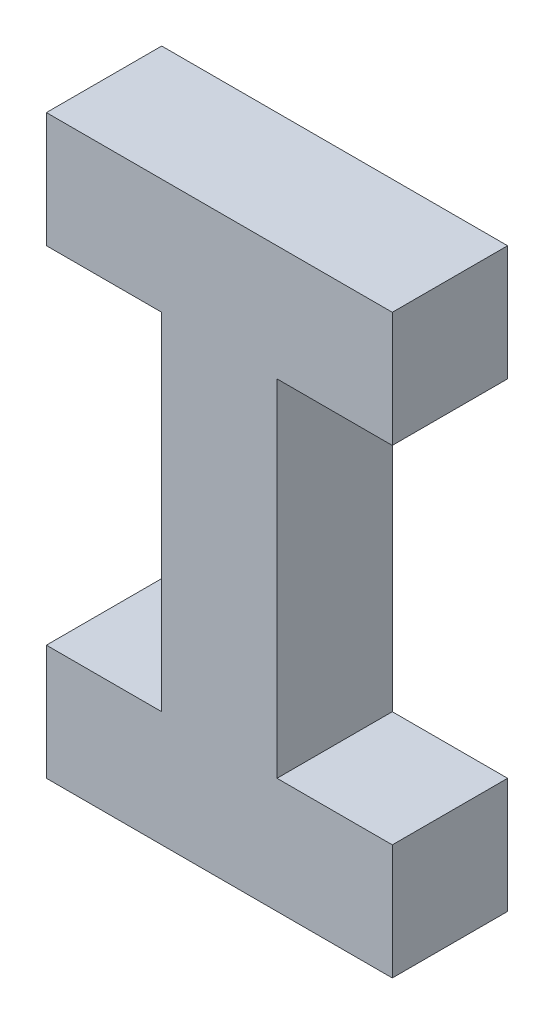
SolidWorks part; units mm, degrees
ref_plane "Plan de face" through (0, 0, 0) normal (0, 0, 1) x (1, 0, 0)
ref_plane "Plan de dessus" through (0, 0, 0) normal (0, 1, 0) x (1, 0, 0)
ref_plane "Plan de droite" through (0, 0, 0) normal (1, 0, 0) x (0, 0, -1)
sketch "Esquisse1" plane through (0, 0, 0) normal (0, 0, 1) x (1, 0, 0)
  line L0 (20, 40) -> (30, 40)
  line L1 (0, 0) -> (30, 0)
  line L2 (0, 0) -> (0, 10)
  line L3 (0, 10) -> (10, 10)
  line L4 (30, 0) -> (30, 10)
  line L6 (10, 10) -> (10, 40)
  line L7 (20, 10) -> (30, 10)
  line L8 (20, 10) -> (20, 40)
  line L9 (0, 40) -> (10, 40)
  line L10 (0, 40) -> (0, 50)
  line L11 (0, 50) -> (30, 50)
  line L12 (30, 40) -> (30, 50)
  dimension "D1" = 10
  dimension "D2" = 10
  dimension "D3" = 30
  dimension "D4" = 50
  dimension "D5" = 30
  dimension "D6" = 30
  dimension "D7" = 10
  dimension "D8" = 10
extrude "Boss.-Extru.1" add sketch "Esquisse1" along normal blind 10
